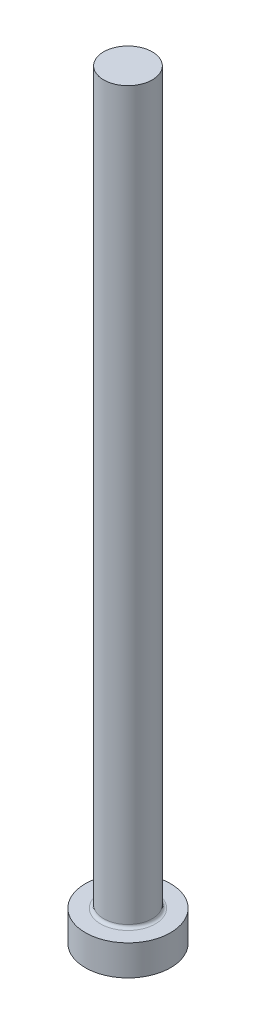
SolidWorks part; units mm, degrees
ref_plane "Plano frontal" through (0, 0, 0) normal (0, 0, 1) x (1, 0, 0)
ref_plane "Plano superior" through (0, 0, 0) normal (0, 1, 0) x (1, 0, 0)
ref_plane "Plano direito" through (0, 0, 0) normal (1, 0, 0) x (0, 0, -1)
sketch "Esboço1" plane through (0, 0, 0) normal (0, 0, 1) x (1, 0, 0)
  line L0 (0, 0) -> (7, 0)
  line L1 (7, 0) -> (7, 5)
  line L2 (7, 5) -> (4.5, 5)
  line L3 (4, 5.5) -> (4, 125)
  line L4 (4, 125) -> (0, 125)
  line L5 (0, 125) -> (0, 0) construction
  line L6 (0, 0) -> (0, 125)
  arc A0 (4.5, 5) -> (4, 5.5) centre (4.5, 5.5) cw
  dimension "D3" = 0.5
  dimension "D1" = 14
  dimension "D2" = 8
  dimension "D4" = 5
  dimension "D5" = 125
revolve "Revolução1" add sketch "Esboço1" angle 360 about L5
sketch "Esboço2"
  dimension "D1" = 0.525
  dimension "D2" = 1.225
  dimension "D3" = 0.7875
  dimension "D4" = 3.7625
wrap "Envolver1" sketch "Esboço2" wrap type deboss source sketch "Esboço2" thickness 0.1 parameters "D1"=0.1
